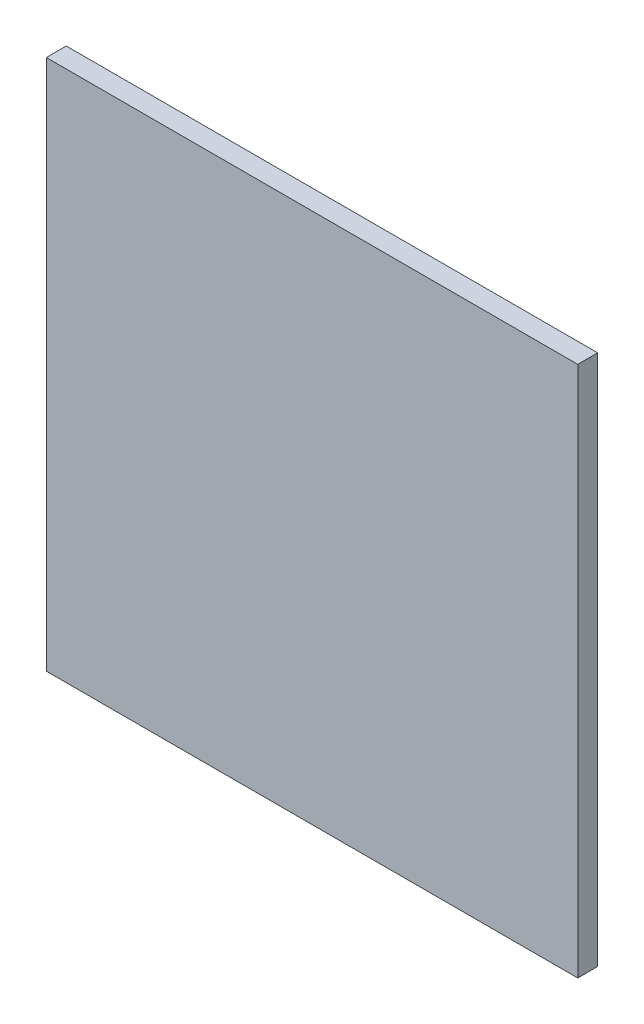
SolidWorks part; units mm, degrees
ref_plane "Alzado" through (0, 0, 0) normal (0, 0, 1) x (1, 0, 0)
ref_plane "Planta" through (0, 0, 0) normal (0, 1, 0) x (1, 0, 0)
ref_plane "Vista lateral" through (0, 0, 0) normal (1, 0, 0) x (0, 0, -1)
sketch "Croquis1" plane through (0, 0, 0) normal (0, 0, 1) x (1, 0, 0)
  line L1 (-200, 200) -> (200, 200)
  line L2 (-200, 200) -> (-200, -200)
  line L3 (-200, -200) -> (200, -200)
  line L4 (200, 200) -> (200, -200)
  line L5 (-200, 200) -> (200, -200) construction
  line L6 (-200, -200) -> (200, 200) construction
  point P0 (0, 0)
  dimension "D1" = 400
  dimension "D2" = 400
extrude "Saliente-Extruir1" add sketch "Croquis1" along normal blind 15
